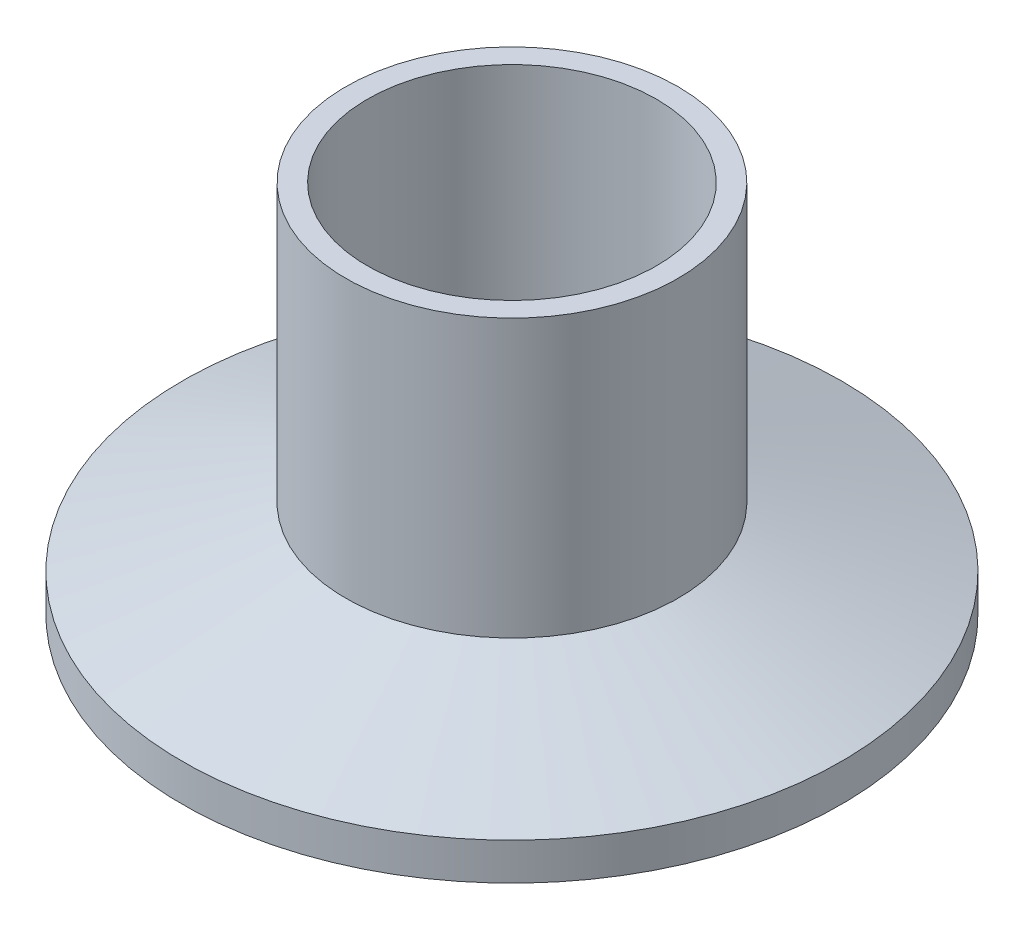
SolidWorks part; units mm, degrees
ref_plane "Front Plane" through (0, 0, 0) normal (0, 0, 1) x (1, 0, 0)
ref_plane "Top Plane" through (0, 0, 0) normal (0, 1, 0) x (1, 0, 0)
ref_plane "Right Plane" through (0, 0, 0) normal (1, 0, 0) x (0, 0, -1)
sketch "Sketch1" plane through (0, 0, 0) normal (0, 0, 1) x (1, 0, 0)
  line L0 (0, 0) -> (0, 28.575) construction
  line L1 (0, 28.575) -> (-12.7, 28.575)
  line L2 (-12.7, 28.575) -> (-12.7, 7.3933)
  line L3 (-12.7, 7.3933) -> (-25.1968, 2.8448)
  line L4 (-25.1968, 2.8448) -> (-25.1968, 0)
  line L5 (-25.1968, 0) -> (-23.6366, 0)
  line L6 (-20.0006, 0) -> (0, 0)
  line L7 (0, 0) -> (0, 28.575)
  line L8 (0, 28.575) -> (-11.049, 28.575)
  line L9 (-11.049, 28.575) -> (-11.049, 0)
  line L10 (-11.049, 0) -> (0, 0)
  line L11 (0, 0) -> (-0.1846, 0.0129)
  arc A0 (-22.9141, 0.4745) -> (-20.7231, 0.4745) centre (-21.8186, 0) cw
  arc A1 (-20.0006, 0) -> (-20.7231, 0.4745) centre (-20.0006, 0.7874) cw
  arc A2 (-22.9141, 0.4745) -> (-23.6366, 0) centre (-23.6366, 0.7874) cw
  point P12 (-20.6248, 0)
  dimension "D1" = 12.7
  dimension "D2" = 7.3933
  dimension "D3" = 25.1968
  dimension "D8" = 1.651
  dimension "D9" = 28.575
revolve "Revolve2" add sketch "Sketch1" angle 360 about L0
